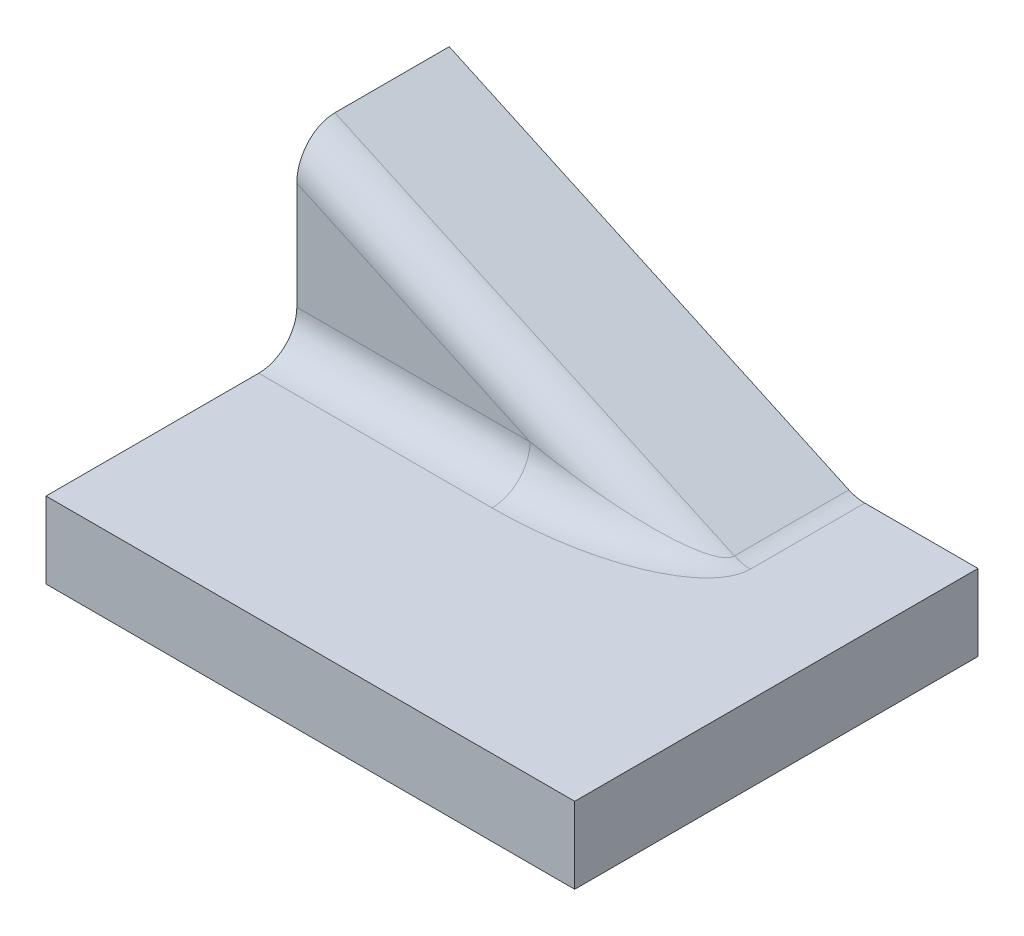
SolidWorks part; units mm, degrees
ref_plane "Front Plane" through (0, 0, 0) normal (0, 0, 1) x (1, 0, 0)
ref_plane "Top Plane" through (0, 0, 0) normal (0, 1, 0) x (1, 0, 0)
ref_plane "Right Plane" through (0, 0, 0) normal (1, 0, 0) x (0, 0, -1)
sketch "Sketch1" plane through (0, 0, 0) normal (0, 1, 0) x (1, 0, 0)
  line L1 (-88.0844, -67.183) -> (88.0844, -67.183)
  line L2 (-88.0844, -67.183) -> (-88.0844, 67.183)
  line L3 (-88.0844, 67.183) -> (88.0844, 67.183)
  line L4 (88.0844, -67.183) -> (88.0844, 67.183)
  line L5 (-88.0844, -67.183) -> (88.0844, 67.183) construction
  line L6 (-88.0844, 67.183) -> (88.0844, -67.183) construction
  point P0 (0, 0)
extrude "Boss-Extrude1" add sketch "Sketch1" along normal blind 25.4
sketch "Sketch2" plane through (0, 0, -67.183) normal (0, 0, -1) x (-1, 0, 0)
  line L0 (-47.5795, 25.4) -> (88.0844, 87.8756)
  line L1 (-88.0844, 25.4) -> (88.0844, 25.4) construction
  line L2 (88.0844, 87.8756) -> (88.0844, 25.4)
  line L3 (88.0844, 25.4) -> (-47.5795, 25.4)
extrude "Boss-Extrude2" add sketch "Sketch2" against normal blind 50.8
fillet "Fillet2" radius 12.7 1 edges at (-20.2525, 56.6378, -16.383)
fillet "Fillet1" radius 12.7 3 edges at (38.6868, 25.4, -20.1028)
